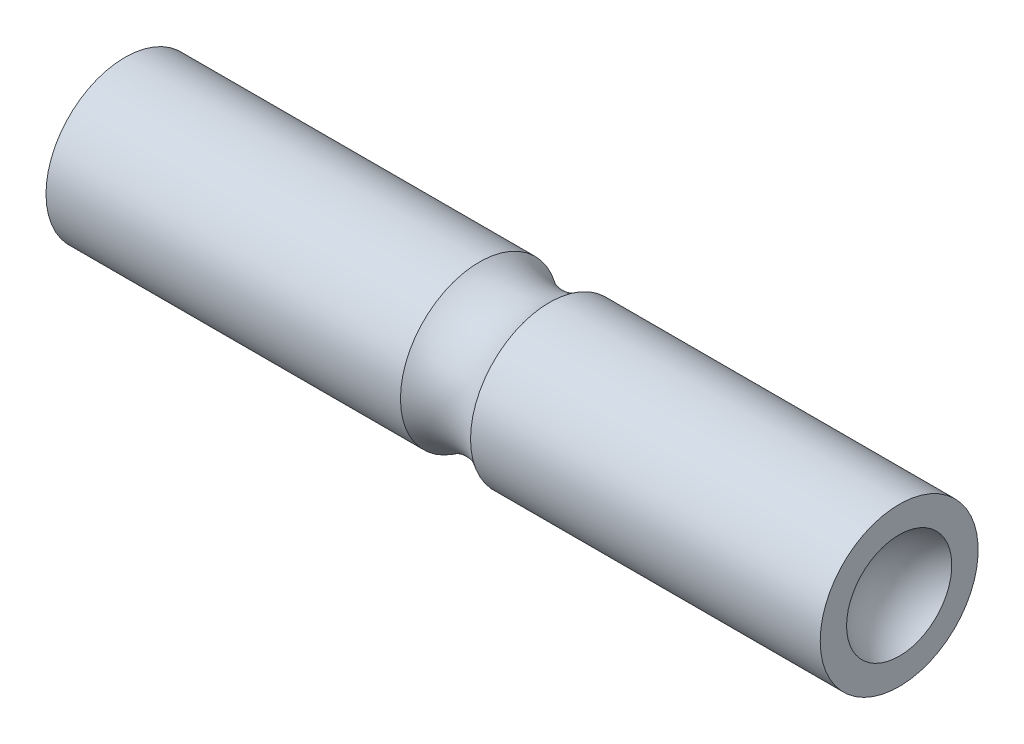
SolidWorks part; units mm, degrees
ref_plane "Front Plane" through (0, 0, 0) normal (0, 0, 1) x (1, 0, 0)
ref_plane "Top Plane" through (0, 0, 0) normal (0, 1, 0) x (1, 0, 0)
ref_plane "Right Plane" through (0, 0, 0) normal (1, 0, 0) x (0, 0, -1)
sketch "Sketch1" plane through (0, 0, 0) normal (0, 0, 1) x (1, 0, 0)
  line L0 (10.287, 1.702) -> (10.287, 0) construction
  line L1 (0, 0) -> (19.177, 0)
  line L2 (0, 0) -> (0, 1.981) construction
  line L3 (0.5155, 1.981) -> (9.4081, 1.981)
  line L4 (19.939, 1.3198) -> (19.939, 1.981)
  line L5 (0, 1.981) -> (0.5155, 1.981) construction
  line L6 (9.4081, 1.981) -> (11.1659, 1.981) construction
  line L7 (10.287, 1.702) -> (9.4081, 1.981) construction
  line L8 (11.1659, 1.981) -> (19.939, 1.981)
  line L9 (19.177, 0) -> (19.939, 0) construction
  line L10 (19.939, 0) -> (19.939, 1.3198) construction
  arc A0 (19.939, 1.3198) -> (19.177, 0) centre (20.701, 0) ccw
  arc A1 (0, 0) -> (0.5155, 1.981) centre (4.064, 0) cw
  arc A2 (9.4081, 1.981) -> (11.1659, 1.981) centre (10.287, 3.226) ccw
  dimension "D4" = 3.048
  dimension "D6" = 4.064
  dimension "D7" = 3.048
  dimension "D1" = 19.939
  dimension "D2" = 1.981
  dimension "D3" = 9.652
  dimension "D5" = 0.762
  dimension "D8" = 1.702
  dimension "D9" = 0
revolve "Revolve1" add sketch "Sketch1" angle 360 about L1
